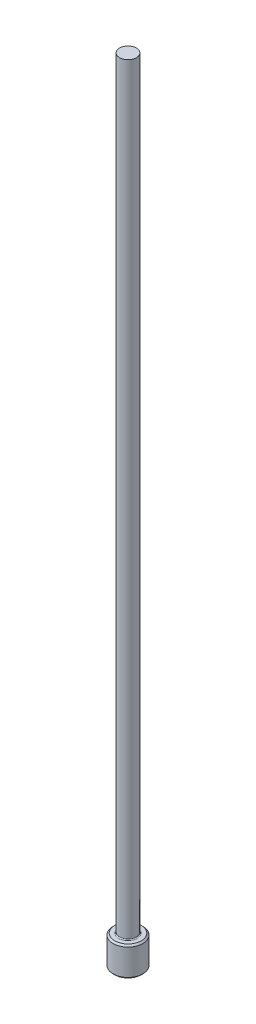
SolidWorks part; units mm, degrees
ref_plane "Front Plane" through (0, 0, 0) normal (0, 0, 1) x (1, 0, 0)
ref_plane "Top Plane" through (0, 0, 0) normal (0, 1, 0) x (1, 0, 0)
ref_plane "Right Plane" through (0, 0, 0) normal (1, 0, 0) x (0, 0, -1)
other "Configuration Table"
sketch "Sketch1" plane through (0, 0, 0) normal (0, 0, 1) x (1, 0, 0)
  line L0 (0, 259.9588) -> (0, -15.1925) construction
  line L1 (0, 0) -> (-1.1938, 0)
  line L2 (-1.1938, 0) -> (-1.1938, 2.3622)
  line L3 (-1.1938, 2.3622) -> (-0.6731, 2.3622)
  line L4 (-0.6731, 2.3622) -> (-0.6731, 63.5)
  line L5 (-0.6731, 63.5) -> (0, 63.5)
  line L6 (0, 63.5) -> (0, 0)
  dimension "L" = 63.5
  dimension "H" = 2.3876
  dimension "T" = 2.3622
  dimension "D" = 1.3462
revolve "Revolve1" add sketch "Sketch1" angle 360 about L0
chamfer "Chamfer1" distance 0.127 angle 45 2 edges at (0, 2.3622, 1.1938) (0, 0, 1.1938)
fillet "Fillet1" radius 0.0762 1 edges at (0, 2.3622, 0.6731)
